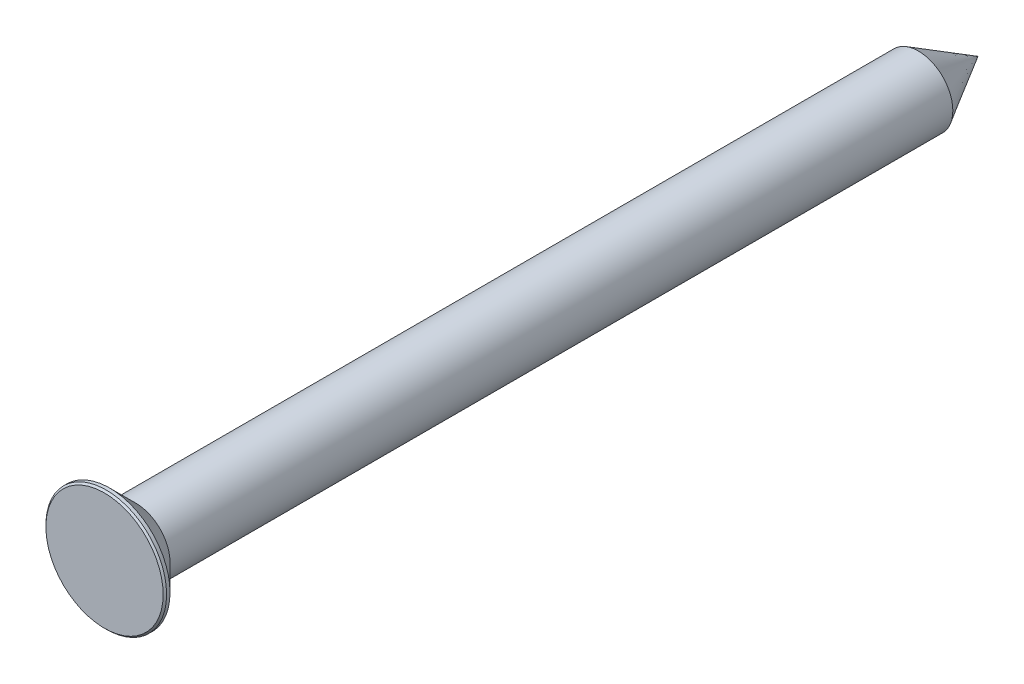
SolidWorks part; units mm, degrees
ref_plane "Спереди" through (0, 0, 0) normal (0, 0, 1) x (1, 0, 0)
ref_plane "Сверху" through (0, 0, 0) normal (0, 1, 0) x (1, 0, 0)
ref_plane "Справа" through (0, 0, 0) normal (1, 0, 0) x (0, 0, -1)
sketch "Эскиз1" plane through (0, 0, 0) normal (1, 0, 0) x (0, 0, -1)
  line L0 (0, 0) -> (50.8, 0)
  line L1 (50.8, 0) -> (47.3359, 2)
  line L2 (47.3359, 2) -> (1.81, 2)
  line L3 (1.81, 2) -> (0.3, 3.51)
  line L4 (0.3, 3.51) -> (0.1, 3.51)
  line L5 (0, 3.41) -> (0, 0)
  line L6 (0, 3.51) -> (0, 3.81) construction
  line L7 (0, 3.81) -> (0.3, 3.51) construction
  line L8 (0.1, 3.51) -> (0, 3.41)
  dimension "D1" = 45
  dimension "D2" = 30
  dimension "D3" = 2
  dimension "D4" = 50.8
  dimension "D5" = 0.3
  dimension "D6" = 3.81
  dimension "D9" = 0.1
revolve "Повернуть1" add sketch "Эскиз1" angle 360 about L0
